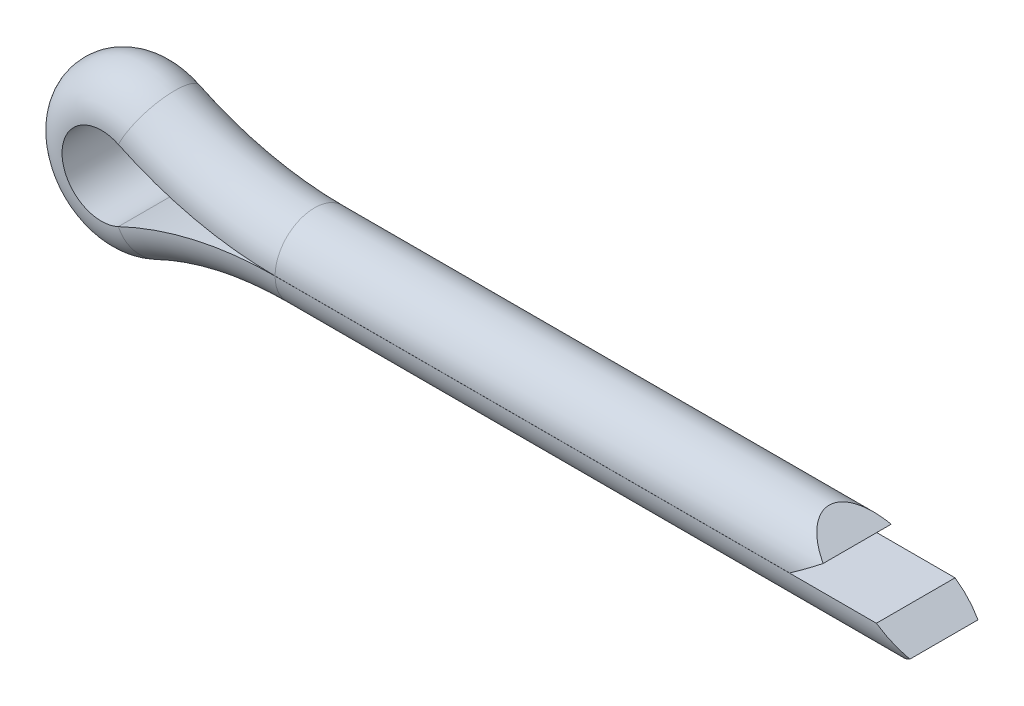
SolidWorks part; units mm, degrees
ref_plane "Front Plane" through (0, 0, 0) normal (0, 0, 1) x (1, 0, 0)
ref_plane "Top Plane" through (0, 0, 0) normal (0, 1, 0) x (1, 0, 0)
ref_plane "Right Plane" through (0, 0, 0) normal (1, 0, 0) x (0, 0, -1)
sketch "PathSke" plane through (0, 0, 0) normal (0, 0, 1) x (1, 0, 0)
  line L0 (0, 0) -> (38.8652, 0) construction
  line L1 (0, 0) -> (0, 12.2501) construction
  line L2 (6.4, 0) -> (6.4, 12.2501) construction
  line L3 (6.4, 1.45) -> (26.4, 1.45)
  line L4 (6.4, -1.45) -> (29.6, -1.45)
  arc A0 (1.2499, 2.6168) -> (1.2499, -2.6168) centre (0, 0) ccw
  arc A1 (6.4, 1.45) -> (1.2499, 2.6168) centre (6.4, 13.3991) cw
  arc A2 (6.4, -1.45) -> (1.2499, -2.6168) centre (6.4, -13.3991) ccw
  dimension "Head_dia" = 5.8
  dimension "Head_height" = 6.4
  dimension "Diameter" = 2.9
  dimension "Length" = 20
  dimension "Tip_offset" = 3.2
ref_plane "SectionPlane" through (26.4, 1.45, 0) normal (1, 0, 0) x (0, 0, -1)
sketch "SectionSke" plane through (26.4, 1.45, 0) normal (1, 0, 0) x (0, 0, -1)
  line L0 (0, -1.45) -> (0, 8.6928) construction
  line L1 (0, -1.45) -> (0, 10.8001) construction
  line L2 (-1.45, -1.45) -> (1.45, -1.45) construction
  line L3 (-1.45, -1.448) -> (1.45, -1.448)
  arc A0 (1.45, -1.448) -> (-1.45, -1.448) centre (0, -1.45) ccw
  dimension "D1" = 0.002
  dimension "Diameter" = 2.9
sweep "BaseBody" add profiles "SectionSke" path "PathSke"
sketch "ConeCutSke" plane through (0, 0, 0) normal (0, 0, 1) x (1, 0, 0)
  line L0 (0, 0) -> (34.6884, 0) construction
  line L1 (25.3575, 1.46) -> (29.61, 1.46)
  line L2 (29.61, 1.46) -> (29.61, -1.46)
  line L3 (26.4, 1.45) -> (6.4, 1.45) construction
  line L4 (25.3575, 1.46) -> (26.4, 0.726)
  line L5 (26.4, 0.002) -> (26.4, 1.45) construction
  line L6 (26.4, 0.726) -> (25.3575, 0)
  line L7 (25.3575, 0) -> (28.5575, 0)
  line L8 (28.5575, 0) -> (29.6, -0.726)
  line L9 (29.6, -1.45) -> (29.6, -0.002) construction
  line L10 (29.6, -0.726) -> (28.5575, -1.46)
  line L11 (28.5575, -1.46) -> (29.61, -1.46)
  point P19 (29.61, 0)
  dimension "D1" = 0.01
  dimension "D2" = 70
  dimension "D3" = 70
  dimension "D4" = 0.01
extrude "ConeCut" cut sketch "ConeCutSke" against normal through all and the other way through all
equation "\"Diameter@SectionSke\" = \"Diameter@PathSke\""
